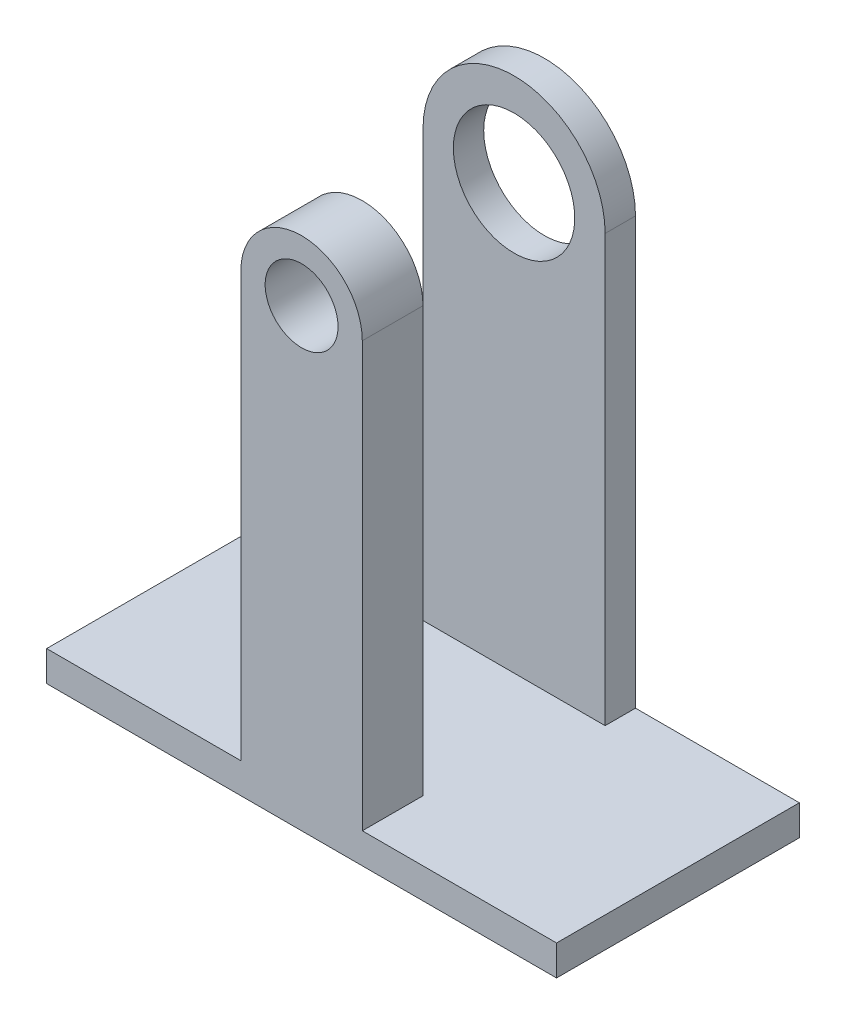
SolidWorks part; units mm, degrees
ref_plane "Face" through (0, 0, 0) normal (0, 0, 1) x (1, 0, 0)
ref_plane "Dessus" through (0, 0, 0) normal (0, 1, 0) x (1, 0, 0)
ref_plane "Droite" through (0, 0, 0) normal (1, 0, 0) x (0, 0, -1)
sketch "Esquisse1" plane through (0, 0, 0) normal (0, 0, 1) x (1, 0, 0)
  circle A0 centre (0, 0) radius 6
  circle A1 centre (0, 0) radius 10
extrude "Extrusion1" add sketch "Esquisse1" along normal blind 10
sketch "Esquisse2" plane through (0, 0, 10) normal (0, 0, 1) x (1, 0, 0)
  line L0 (-10, 0) -> (-10, -70)
  line L1 (10, 0) -> (10, -70)
  line L2 (10, -70) -> (-10, -70)
  circle A0 centre (0, 0) radius 10 construction
  arc A1 (-10, 0) -> (10, 0) centre (0, 0) ccw
  dimension "D1" = 70
extrude "Extrusion2" add sketch "Esquisse2" against normal blind 10
sketch "Esquisse3" plane through (0, 0, 10) normal (0, 0, 1) x (1, 0, 0)
  line L0 (0, 0) -> (0, -62.1981) construction
  line L1 (-42, -74.9116) -> (42, -74.9116)
  line L2 (-42, -74.9116) -> (-42, -69.9116)
  line L3 (-42, -69.9116) -> (42, -69.9116)
  line L4 (42, -74.9116) -> (42, -69.9116)
  dimension "D1" = 42
  dimension "D2" = 42
  dimension "D3" = 5
extrude "Extrusion3" add sketch "Esquisse3" against normal blind 40
sketch "Esquisse4" plane through (0, 0, -30) normal (0, 0, -1) x (-1, 0, 0)
  line L0 (-15.0037, 0.3111) -> (-15.0037, -74.9116)
  line L2 (42, -74.9116) -> (-42, -74.9116) construction
  line L3 (14.9963, 0.3111) -> (14.9963, -74.9116)
  line L4 (14.9963, -74.9116) -> (-15.0037, -74.9116)
  circle A0 centre (0, 0) radius 10
  arc A1 (14.9963, 0.3111) -> (-15.0037, 0.3111) centre (-0.0037, 0.3111) ccw
extrude "Extrusion4" add sketch "Esquisse4" against normal up to surface (5 mm away)
